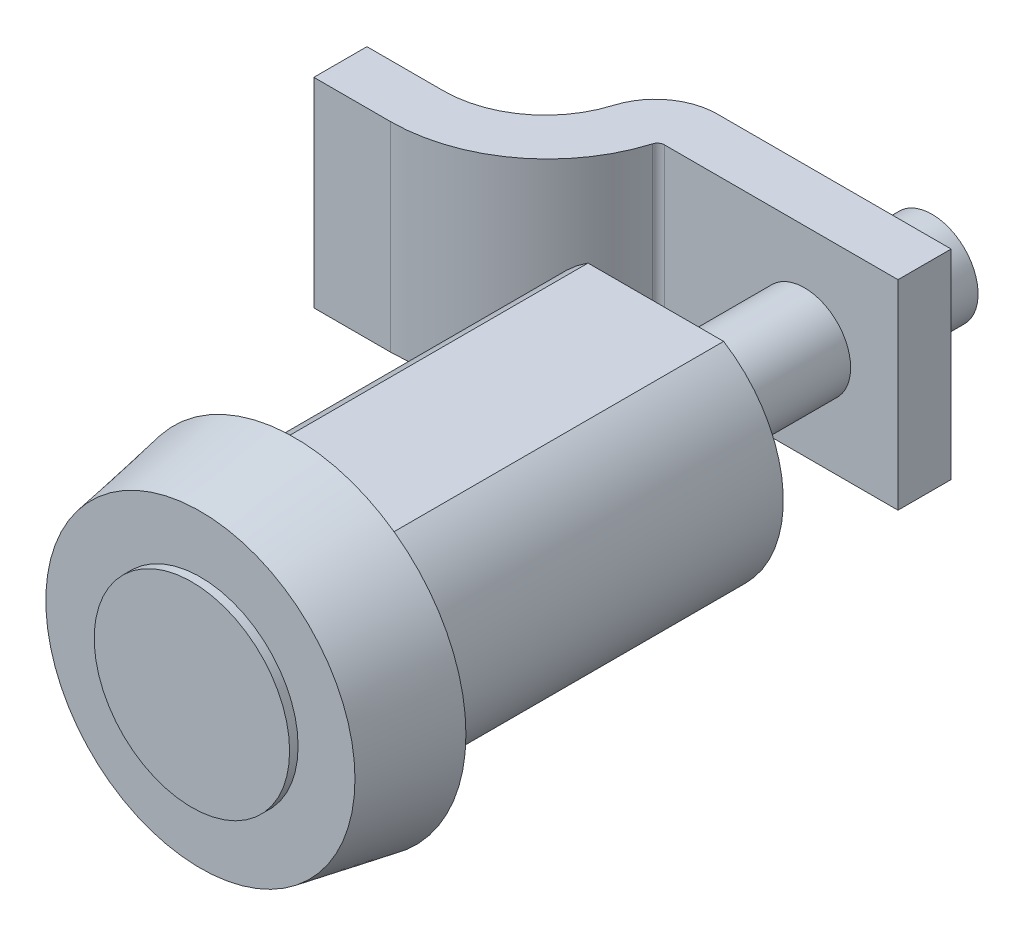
SolidWorks part; units mm, degrees
ref_plane "Front Plane" through (0, 0, 0) normal (0, 0, 1) x (1, 0, 0)
ref_plane "Top Plane" through (0, 0, 0) normal (0, 1, 0) x (1, 0, 0)
ref_plane "Right Plane" through (0, 0, 0) normal (1, 0, 0) x (0, 0, -1)
sketch "Sketch1" plane through (0, 0, 0) normal (0, 0, 1) x (1, 0, 0)
  circle A1 centre (0, 0) radius 10.2362
  dimension "D1" = 20.4724
extrude "Boss-Extrude1" add sketch "Sketch1" along normal blind 5.6388
draft "Draft1" type of draft neutral plane draft angle 10 faces to draft 1 parameters "D1"=10
sketch "Sketch2" plane through (0, 0, 5.6388) normal (0, 0, 1) x (1, 0, 0)
  circle A0 centre (0, 0) radius 5.842
  dimension "D1" = 11.684
extrude "Boss-Extrude2" add sketch "Sketch2" along normal blind 0.508
sketch "Sketch3" plane through (0, 0, 0) normal (0, 0, -1) x (-1, 0, 0)
  line L0 (-4.0548, 6.4516) -> (4.0548, 6.4516)
  line L1 (0, 0) -> (11.6382, 0) construction
  line L2 (-4.0548, -6.4516) -> (4.0548, -6.4516)
  arc A0 (-4.0548, 6.4516) -> (-4.0548, -6.4516) centre (0, 0) ccw
  arc A1 (4.0548, -6.4516) -> (4.0548, 6.4516) centre (0, 0) ccw
  dimension "D1" = 15.24
  dimension "D2" = 6.4516
extrude "Boss-Extrude3" add sketch "Sketch3" along normal blind 21.59
sketch "Sketch4" plane through (0, 0, -21.59) normal (0, 0, -1) x (-1, 0, 0)
  circle A0 centre (0, 0) radius 2.7559
  dimension "D1" = 5.5118
extrude "Boss-Extrude4" add sketch "Sketch4" along normal blind 16.51
sketch "Sketch6" plane through (0, 0, 0) normal (0, 1, 0) x (1, 0, 0)
  line L0 (5.588, 33.655) -> (5.588, 30.48)
  line L1 (5.588, 30.48) -> (-8.382, 30.48)
  line L2 (-17.78, 23.495) -> (-22.352, 23.495)
  line L3 (-22.352, 23.495) -> (-22.352, 26.67)
  line L4 (-22.352, 26.67) -> (-17.78, 26.67)
  line L5 (-8.382, 33.655) -> (5.588, 33.655)
  line L6 (10.2362, 0) -> (-10.2362, 0) construction
  arc A0 (-8.382, 30.48) -> (-8.7811, 30.1834) centre (-8.382, 30.0632) ccw
  arc A1 (-8.7811, 30.1834) -> (-17.78, 23.495) centre (-17.78, 32.893) cw
  arc A2 (-17.78, 26.67) -> (-11.9429, 31.0084) centre (-17.78, 32.766) ccw
  arc A3 (-11.9429, 31.0084) -> (-8.382, 33.655) centre (-8.382, 29.9362) cw
  dimension "D5" = 30.48
  dimension "D9" = 6.096
  dimension "D10" = 9.398
  dimension "D1" = 3.175
  dimension "D2" = 3.175
  dimension "D3" = 5.588
  dimension "D4" = 27.94
  dimension "D6" = 13.97
  dimension "D7" = 4.572
  dimension "D8" = 10.16
extrude "Boss-Extrude5" add sketch "Sketch6" along normal blind 5.969 and the other way blind 5.969
